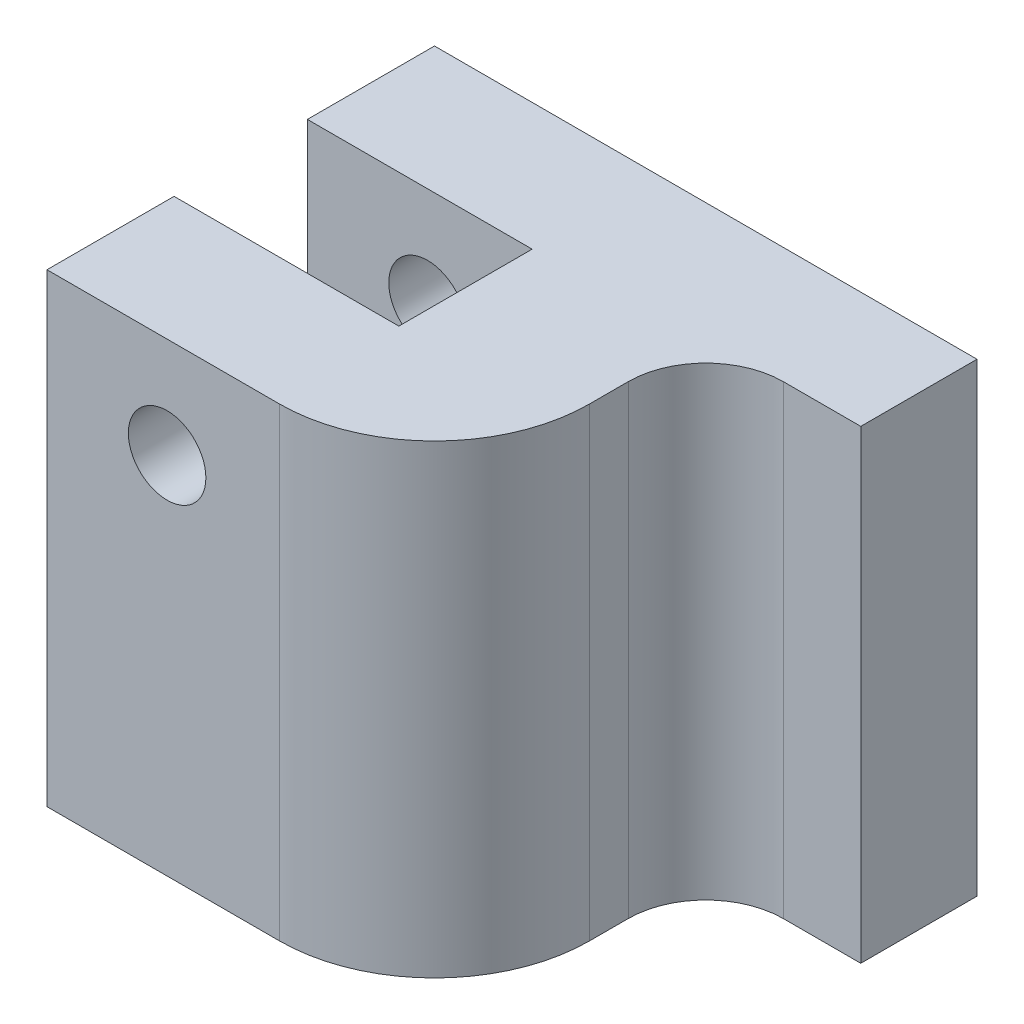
SolidWorks part; units mm, degrees
other "<GasShockEndHolder>-<Fillet1>"
ref_plane "Front" through (0, 0, 0) normal (0, 0, 1) x (1, 0, 0)
ref_plane "Top" through (0, 0, 0) normal (0, 1, 0) x (1, 0, 0)
ref_plane "Right" through (0, 0, 0) normal (1, 0, 0) x (0, 0, -1)
mirrored part "GasShockEndHolder_Mirrored"
